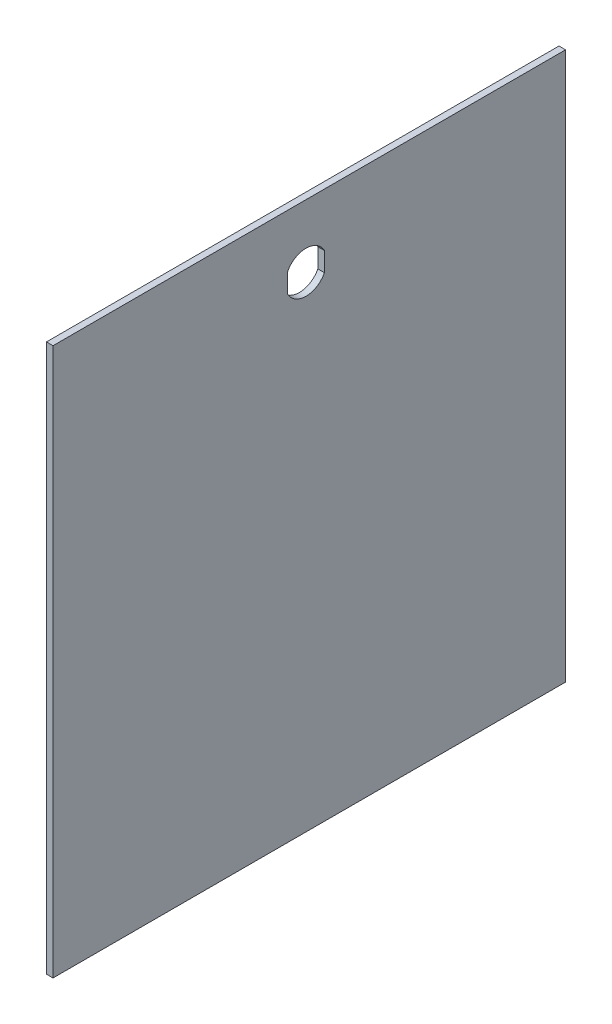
SolidWorks part; units mm, degrees
ref_plane "Front" through (0, 0, 0) normal (0, 0, 1) x (1, 0, 0)
ref_plane "Top" through (0, 0, 0) normal (0, 1, 0) x (1, 0, 0)
ref_plane "Right" through (0, 0, 0) normal (1, 0, 0) x (0, 0, -1)
sketch "Sketch1" plane through (0, 0, 0) normal (1, 0, 0) x (0, 0, -1)
  line L1 (-117, -125) -> (117, -125)
  line L2 (-117, -125) -> (-117, 125)
  line L3 (-117, 125) -> (117, 125)
  line L4 (117, -125) -> (117, 125)
  line L5 (-117, -125) -> (117, 125) construction
  line L6 (-117, 125) -> (117, -125) construction
  line L8 (6.9205, 100.6984) -> (6.9205, 91.9016)
  line L9 (-9.9544, 91.9672) -> (-9.9544, 100.6328)
  arc A0 (6.9205, 100.6984) -> (-9.9544, 100.6328) centre (-1.5, 96.3) ccw
  arc A1 (-9.9544, 91.9672) -> (6.9205, 91.9016) centre (-1.5, 96.3) ccw
  point P0 (0, 0)
  dimension "D3" = 28.7
  dimension "D1" = 234
  dimension "D2" = 250
  dimension "D4" = 115.5
base flange "Base-Flange1" sketch "Sketch1" thickness 3 reverse thickness direction no parameters "D1"=2
sketch "Bend-Lines1" [suppressed] plane through (0, 0, 0) normal (0, 1, 0) x (1, 0, 0)
sketch "Bounding-Box1" [suppressed] plane through (0, 0, 0) normal (0, 1, 0) x (1, 0, 0)
sheet metal parameters "Sheet-Metal1" thickness 3 parameters "D1"=2
flat pattern "Flat-Pattern1"
sketch "Bend-Lines2" plane through (0, 0, 0) normal (0, 1, 0) x (1, 0, 0)
sketch3d "Bounding-Box2" [suppressed]
  line L0 (-117, 125, 0) -> (-117, -125, 0) construction
  line L1 (117, 125, 0) -> (117, -125, 0) construction
  line L2 (-117, 125, 0) -> (117, 125, 0) construction
  line L3 (-117, -125, 0) -> (117, -125, 0) construction
